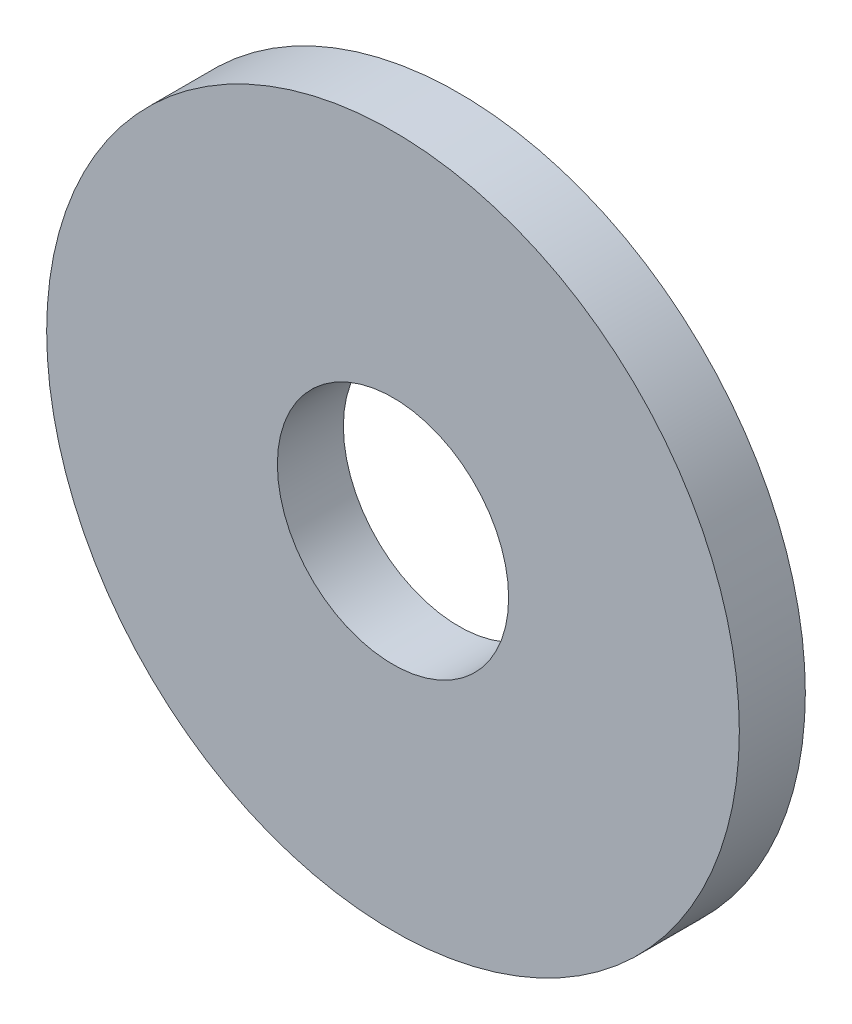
SolidWorks part; units mm, degrees
ref_plane "Front Plane" through (0, 0, 0) normal (0, 0, 1) x (1, 0, 0)
ref_plane "Top Plane" through (0, 0, 0) normal (0, 1, 0) x (1, 0, 0)
ref_plane "Right Plane" through (0, 0, 0) normal (1, 0, 0) x (0, 0, -1)
sketch "Sketch1" plane through (0, 0, 0) normal (0, 0, 1) x (1, 0, 0)
  circle A0 centre (0, 0) radius 2.7813
  circle A1 centre (0, 0) radius 8.3312
  dimension "D1" = 5.5626
  dimension "D2" = 16.6624
extrude "Boss-Extrude1" add sketch "Sketch1" along normal blind 1.5875
